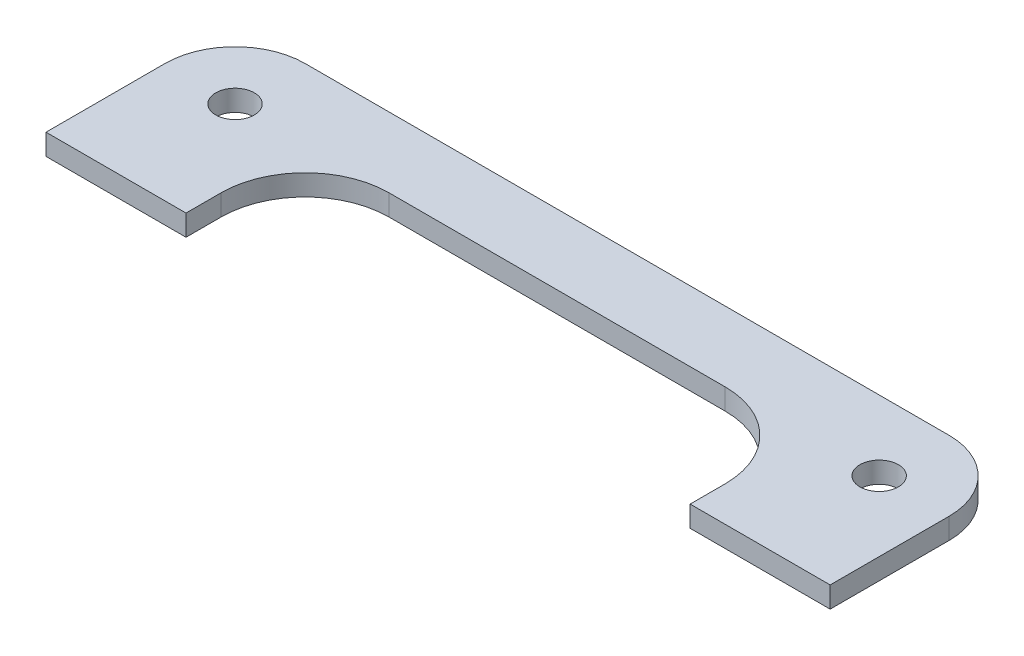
SolidWorks part; units mm, degrees
ref_plane "Front Plane" through (0, 0, 0) normal (0, 0, 1) x (1, 0, 0)
ref_plane "Top Plane" through (0, 0, 0) normal (0, 1, 0) x (1, 0, 0)
ref_plane "Right Plane" through (0, 0, 0) normal (1, 0, 0) x (0, 0, -1)
sketch "Sketch1" plane through (0, 0, 0) normal (0, 1, 0) x (1, 0, 0)
  line L0 (0, 0) -> (0, 17)
  line L1 (10, 27) -> (102, 27)
  line L2 (112, 17) -> (112, 0)
  line L3 (112, 0) -> (92, 0)
  line L4 (92, 0) -> (92, 5)
  line L5 (80, 17) -> (32, 17)
  line L6 (20, 5) -> (20, 0)
  line L7 (20, 0) -> (0, 0)
  arc A0 (0, 17) -> (10, 27) centre (10, 17) cw
  arc A1 (112, 17) -> (102, 27) centre (102, 17) ccw
  arc A2 (20, 5) -> (32, 17) centre (32, 5) cw
  arc A3 (92, 5) -> (80, 17) centre (80, 5) ccw
  circle A4 centre (10, 17) radius 2.75
  circle A5 centre (102, 17) radius 2.75
  point P11 (0, 27)
  point P14 (112, 27)
  dimension "D6" = 10
  dimension "D7" = 12
  dimension "D8" = 5.5
  dimension "D9" = 5.5
  dimension "D1" = 112
  dimension "D2" = 20
  dimension "D3" = 20
  dimension "D4" = 10
  dimension "D5" = 27
extrude "Extrude1" add sketch "Sketch1" along normal blind 3
